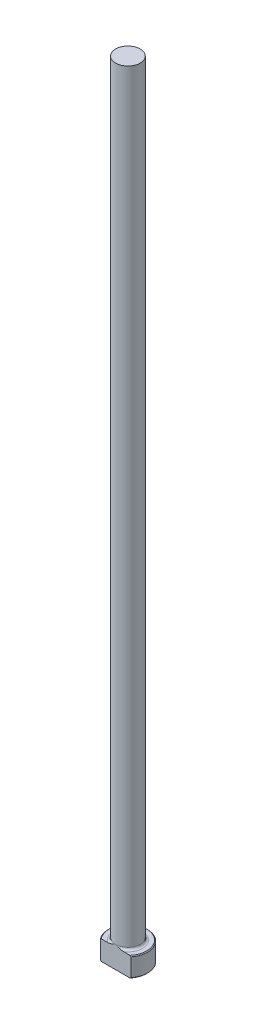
SolidWorks part; units mm, degrees
ref_plane "Front Plane" through (0, 0, 0) normal (0, 0, 1) x (1, 0, 0)
ref_plane "Top Plane" through (0, 0, 0) normal (0, 1, 0) x (1, 0, 0)
ref_plane "Right Plane" through (0, 0, 0) normal (1, 0, 0) x (0, 0, -1)
sketch "Sketch1" plane through (0, 0, 0) normal (0, 0, 1) x (1, 0, 0)
  line L0 (0, 259.9588) -> (0, -15.1925) construction
  line L1 (0, 0) -> (-6.35, 0)
  line L2 (-6.35, 0) -> (-6.35, 6.35)
  line L3 (-6.35, 6.35) -> (-3.9687, 6.35)
  line L4 (-3.9687, 6.35) -> (-3.9687, 254)
  line L5 (-3.9687, 254) -> (0, 254)
  line L6 (0, 254) -> (0, 0)
  dimension "L" = 254
  dimension "H" = 12.7
  dimension "T" = 6.35
  dimension "D" = 7.9375
revolve "Revolve1" add sketch "Sketch1" angle 360 about L0
chamfer "Chamfer1" distance 0.254 angle 45 2 edges at (0, 6.35, 6.35) (0, 0, 6.35)
fillet "Fillet1" radius 0.762 1 edges at (0, 6.35, 3.9687)
sketch "Sketch2" plane through (0, 0, 0) normal (0, -1, 0) x (1, 0, 0)
  line L0 (-4.957, 3.9687) -> (4.957, 3.9687)
  arc A0 (4.957, 3.9687) -> (-4.957, 3.9687) centre (0, 0) ccw
  circle A1 centre (0, 0) radius 6.35 construction
  circle A3 centre (0, 0) radius 3.9687 construction
extrude "KEY" cut sketch "Sketch2" against normal through all
sketch "Pocket Sketch" plane through (0, 0, 0) normal (0, 0, 1) x (1, 0, 0)
  line L0 (-6.7469, 0) -> (-6.7469, 6.3754)
  line L1 (-6.7469, 6.3754) -> (-5.1276, 6.3754)
  line L2 (-4.3656, 7.1374) -> (-4.3656, 22.225)
  line L3 (-4.3656, 22.225) -> (0, 22.225)
  line L4 (0, 22.225) -> (0, 0)
  line L5 (0, 0) -> (-6.7469, 0)
  line L6 (0, 12.6104) -> (0, -2.4989) construction
  line L7 (-6.35, 6.096) -> (-6.35, 0.254) construction
  line L8 (6.096, 6.35) -> (-6.096, 6.35) construction
  line L9 (-3.9687, 254) -> (-3.9687, 7.112) construction
  line L10 (-5.1276, 6.3754) -> (-4.3656, 7.1374)
  point P3 (-4.3656, 6.3754)
  dimension "D1" = 13.4937
  dimension "D2" = 0.3969
  dimension "D3" = 0.0254
  dimension "D4" = 0.3969
  dimension "D5" = 8.7312
  dimension "D6" = 22.225
